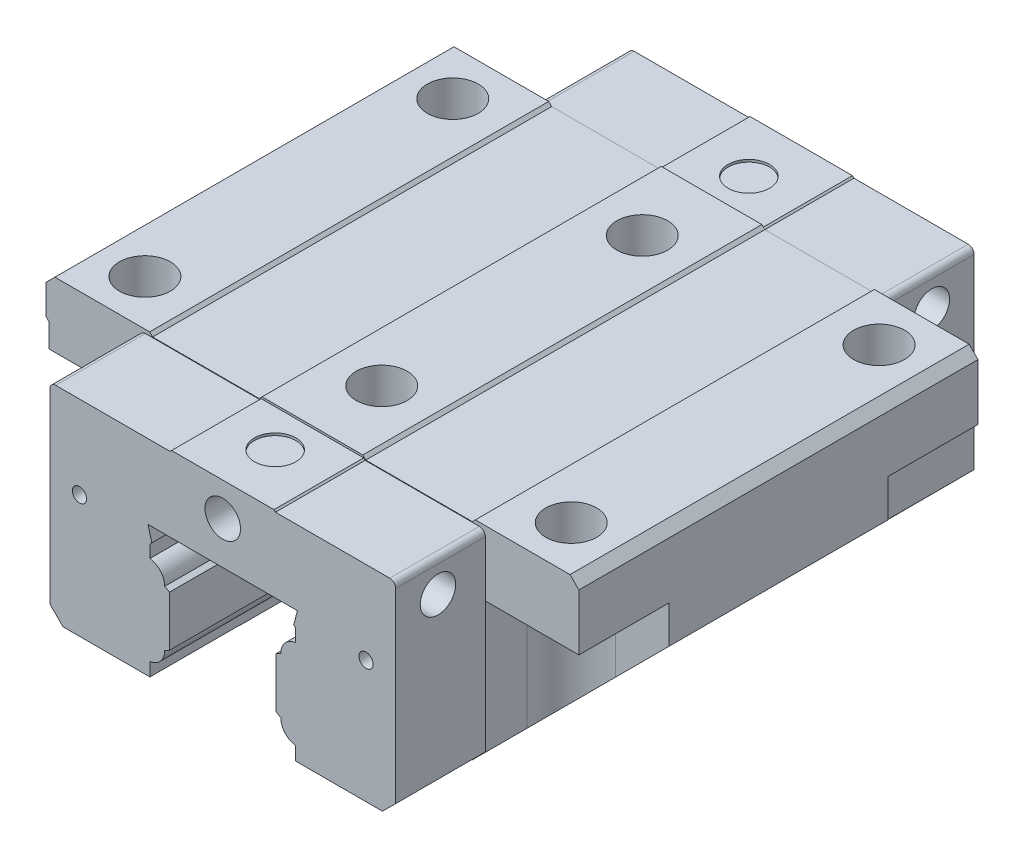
SolidWorks part; units mm, degrees
ref_plane "Ebene vorne" through (0, 0, 0) normal (0, 0, 1) x (1, 0, 0)
ref_plane "Ebene oben" through (0, 0, 0) normal (0, 1, 0) x (1, 0, 0)
ref_plane "Ebene rechts" through (0, 0, 0) normal (1, 0, 0) x (0, 0, -1)
imported_body "Importiert1"
other "Fläche löschen4"
